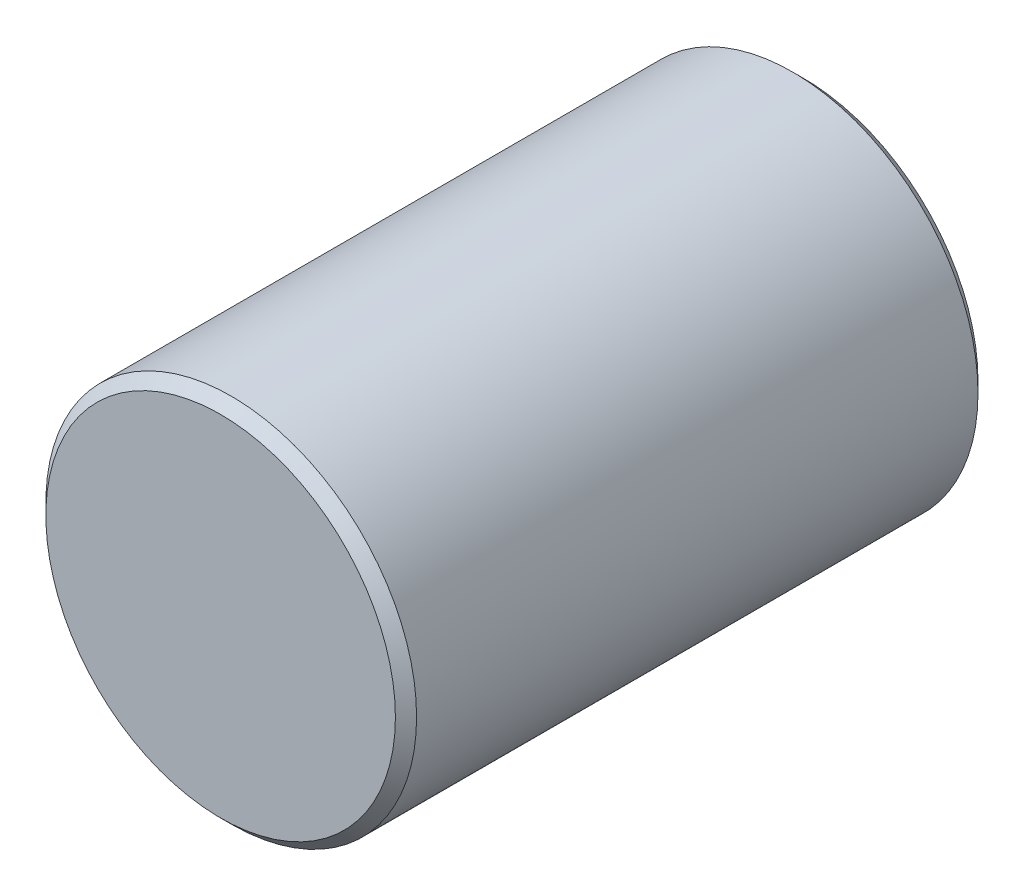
SolidWorks part; units mm, degrees
ref_plane "Plan de face" through (0, 0, 0) normal (0, 0, 1) x (1, 0, 0)
ref_plane "Plan de dessus" through (0, 0, 0) normal (0, 1, 0) x (1, 0, 0)
ref_plane "Plan de droite" through (0, 0, 0) normal (1, 0, 0) x (0, 0, -1)
sketch "Esquisse1" plane through (0, 0, 0) normal (0, 0, 1) x (1, 0, 0)
  circle A0 centre (0, 0) radius 17.5
  dimension "D1" = 35
extrude "Extrusion1" add sketch "Esquisse1" along normal blind 55
chamfer "Chanfrein1" distance 1 angle 45 2 edges at (17.5, 0, 0) (17.5, 0, 55)
hole_wizard "Trou taraudé M6x1.02" positions "Esquisse4" profile "Esquisse3" tap size "M6x1.0" standard "ISO"
sketch "Esquisse4" plane through (0, 0, 0) normal (0, 0, -1) x (-1, 0, 0)
  point P1 (0, 0)
sketch "Esquisse3" plane through (0, 0, 0) normal (1, 0, 0) x (0, 1, 0)
  line L0 (0, 0) -> (0, 16.5022)
  line L1 (0, 16.5022) -> (2.5, 15)
  line L2 (2.5, 15) -> (2.5, 0)
  line L5 (2.5, 0) -> (0, 0)
  line L10 (0, 16.5022) -> (-2.5, 15) construction
  line L11 (0, -6.35) -> (0, 107.95) construction
  dimension "Diamètre du trou pour taraudage" = 5
  dimension "Profondeur du trou pour taraudage" = 15
  dimension "Angle de pointe" = 118
